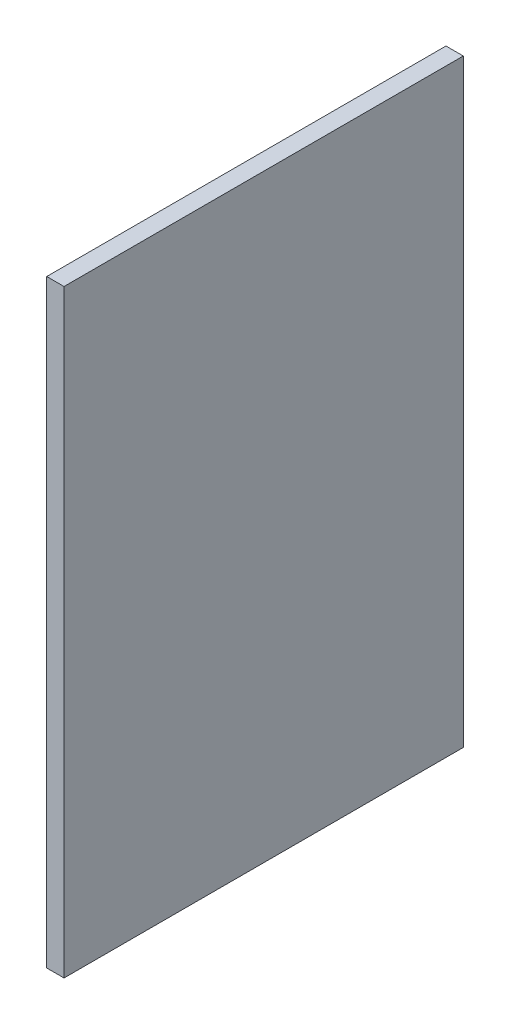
SolidWorks part; units mm, degrees
ref_plane "Front Plane" through (0, 0, 0) normal (0, 0, 1) x (1, 0, 0)
ref_plane "Top Plane" through (0, 0, 0) normal (0, 1, 0) x (1, 0, 0)
ref_plane "Right Plane" through (0, 0, 0) normal (1, 0, 0) x (0, 0, -1)
ref_plane "Front Plane-Chute_Master" through (0, 0, 0) normal (0, 0, 1) x (1, 0, 0)
ref_plane "Top Plane-Chute_Master" through (0, 0, 0) normal (0, 1, 0) x (1, 0, 0)
ref_plane "Right Plane-Chute_Master" through (0, 0, 0) normal (1, 0, 0) x (0, 0, -1)
sketch "Sketch1-Chute_Master" plane through (0, 0, 0) normal (0, 0, 1) x (1, 0, 0)
  line L1 (50.8, -31.75) -> (-50.8, -31.75) construction
  line L2 (50.8, -31.75) -> (50.8, 31.75) construction
  line L3 (50.8, 31.75) -> (-50.8, 31.75) construction
  line L4 (-50.8, -31.75) -> (-50.8, 31.75) construction
  line L5 (50.8, -31.75) -> (-50.8, 31.75) construction
  line L6 (50.8, 31.75) -> (-50.8, -31.75) construction
  point P0 (0, 0)
  dimension "D1" = 63.5
  dimension "D2" = 101.6
sketch "Sketch2-Chute_Master" plane through (0, 0, 0) normal (0, 1, 0) x (1, 0, 0)
  line L1 (-38.1, 0) -> (38.1, 0) construction
  line L2 (-38.1, 0) -> (-38.1, -76.2) construction
  line L3 (-38.1, -76.2) -> (38.1, -76.2) construction
  line L4 (38.1, 0) -> (38.1, -76.2) construction
  dimension "D1" = 76.2
  dimension "D2" = 76.2
sketch "Sketch3-Chute_Master" plane through (0, 0, 0) normal (1, 0, 0) x (0, 0, -1)
  line L1 (0, 0) -> (-76.2, 0) construction
  line L2 (0, 0) -> (0, 45.72) construction
  line L3 (0, 45.72) -> (-76.2, 45.72) construction
  line L4 (-76.2, 0) -> (-76.2, 45.72) construction
  dimension "D1" = 45.72
inserted part "Chute_Master"
sketch "Sketch4" plane through (0, 0, 0) normal (1, 0, 0) x (0, 0, -1)
  line L0 (0, 27.94) -> (0, -27.94) construction
  line L1 (0, 82.55) -> (-76.2, 82.55)
  line L2 (0, 82.55) -> (0, -31.75)
  line L3 (0, -31.75) -> (-76.2, -31.75)
  line L4 (-76.2, 82.55) -> (-76.2, -31.75)
  line L5 (-76.2, 0) -> (-76.2, 45.72) construction
  dimension "D1" = 114.3
extrude "Boss-Extrude1" add sketch "Sketch4" along normal blind 3.302
equation "\"thick\"= 0.125"
